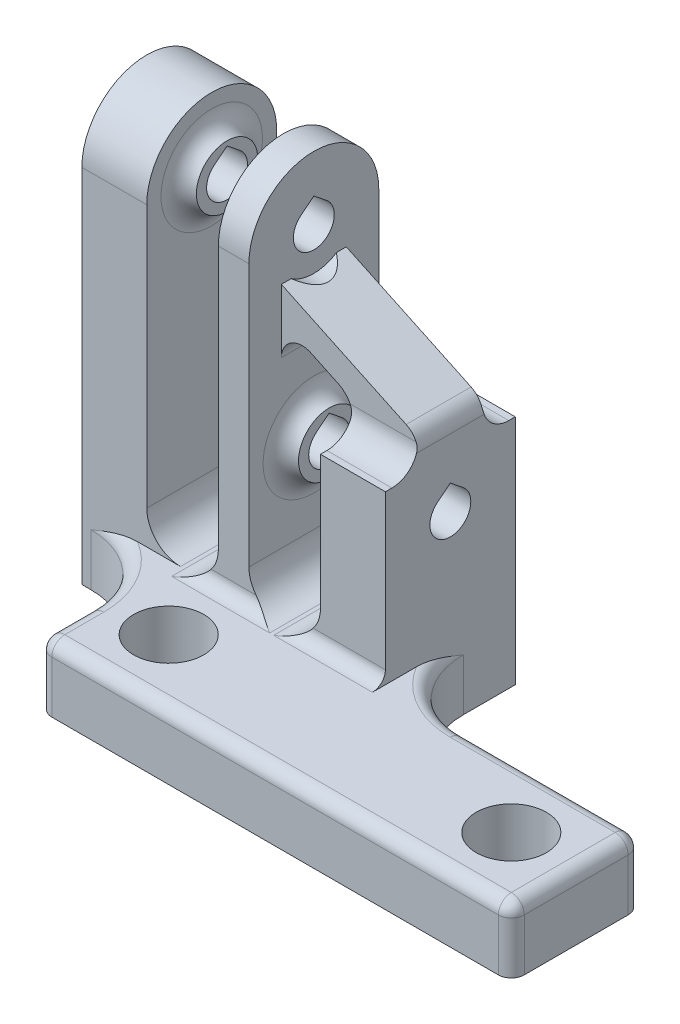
SolidWorks part; units mm, degrees
ref_plane "Front Plane" through (0, 0, 0) normal (0, 0, 1) x (1, 0, 0)
ref_plane "Top Plane" through (0, 0, 0) normal (0, 1, 0) x (1, 0, 0)
ref_plane "Right Plane" through (0, 0, 0) normal (1, 0, 0) x (0, 0, -1)
sketch "Sketch1" plane through (0, 0, 0) normal (0, 0, 1) x (1, 0, 0)
  line L1 (1.4925, 20.8434) -> (-1.4925, 20.8434)
  line L2 (1.4925, 20.8434) -> (1.4925, -20.8434)
  line L3 (1.4925, -20.8434) -> (-1.4925, -20.8434)
  line L4 (-1.4925, 20.8434) -> (-1.4925, -20.8434)
  line L5 (1.4925, 20.8434) -> (-1.4925, -20.8434) construction
  line L6 (1.4925, -20.8434) -> (-1.4925, 20.8434) construction
  point P0 (0, 0)
  dimension "D3" = 2.985
  dimension "D4" = 41.6868
extrude "Boss-Extrude1" add sketch "Sketch1" along normal blind 12.7
sketch "Sketch5" plane through (1.4925, 0, 0) normal (1, 0, 0) x (0, 0, -1)
  line L0 (-12.7, 20.8434) -> (0, 20.8434) construction
  circle A0 centre (-6.35, 14.4934) radius 2
  point P5 (-6.35, 20.8434)
  dimension "D2" = 4
  dimension "D1" = 6.35
extrude "Cut-Extrude2" cut sketch "Sketch5" against normal through all
sketch "Sketch8" plane through (0, 0, 12.7) normal (0, 0, 1) x (1, 0, 0)
  line L0 (1.4925, -20.8434) -> (-1.4925, -20.8434) construction
  line L1 (-6.35, -20.8434) -> (6.35, -20.8434)
  line L2 (-6.35, -20.8434) -> (-6.35, -14.4934)
  line L3 (-6.35, -14.4934) -> (6.35, -14.4934)
  line L4 (6.35, -20.8434) -> (6.35, -14.4934)
  point P5 (0, -14.4934)
  dimension "D1" = 6.35
  dimension "D2" = 12.7
extrude "Boss-Extrude2" add sketch "Sketch8" along normal blind 12.7
sketch "Sketch9" plane through (0, -14.4934, 0) normal (0, 1, 0) x (1, 0, 0)
  line L0 (-6.35, -19.05) -> (6.35, -19.05) construction
  line L1 (-6.35, -25.4) -> (-6.35, -12.7) construction
  line L2 (6.35, -25.4) -> (6.35, -12.7) construction
  circle A0 centre (0, -19.05) radius 3.429
  point P9 (0, -19.05)
  dimension "D1" = 6.858
extrude "Cut-Extrude3" cut sketch "Sketch9" against normal blind 12.7
sketch "Sketch10" plane through (0, 20.8434, 0) normal (0, 1, 0) x (1, 0, 0)
  line L0 (0, -12.7) -> (0, 0) construction
  line L1 (1.4925, -12.7) -> (-1.4925, -12.7) construction
ref_plane "Plane1" through (0, 0, 6.35) normal (0, 0, -1) x (-1, 0, 0)
mirror "Mirror1" about plane through (0, 0, 6.35) normal (0, 0, -1) of "Boss-Extrude2", "Cut-Extrude3"
sketch "Sketch11" plane through (0, 0, 12.7) normal (0, 0, -1) x (-1, 0, 0)
  line L1 (-6.35, -14.4934) -> (6.35, -14.4934)
  line L2 (-6.35, -14.4934) -> (-6.35, -20.8434)
  line L3 (-6.35, -20.8434) -> (6.35, -20.8434)
  line L4 (6.35, -14.4934) -> (6.35, -20.8434)
extrude "Boss-Extrude3" add sketch "Sketch11" along normal up to surface (12.7 mm away)
sketch "Sketch12" plane through (1.4925, 0, 0) normal (1, 0, 0) x (0, 0, -1)
  line L0 (-6.35, -25.0655) -> (-6.35, 25.0655) construction
  circle A0 centre (-6.35, -3.1444) radius 2
  circle A1 centre (-6.35, 14.4934) radius 2 construction
  dimension "D1" = 4
  dimension "D2" = 17.6378
extrude "Cut-Extrude4" cut sketch "Sketch12" against normal up to next
sketch "Sketch15" plane through (-1.4925, 0, 0) normal (-1, 0, 0) x (0, 0, 1)
  circle A0 centre (6.35, 14.4934) radius 3
  circle A1 centre (6.35, 14.4934) radius 2
  circle A2 centre (6.35, 14.4934) radius 2 construction
  dimension "D1" = 1
extrude "Boss-Extrude5" add sketch "Sketch15" along normal blind 1.5
sketch "Sketch16" plane through (1.4925, 0, 0) normal (1, 0, 0) x (0, 0, -1)
  circle A0 centre (-6.35, -3.1444) radius 3
  circle A1 centre (-6.35, -3.1444) radius 2
  circle A2 centre (-6.35, -3.1444) radius 2 construction
  dimension "D1" = 1
extrude "Boss-Extrude6" add sketch "Sketch16" along normal blind 1.5
sketch "Sketch13" plane through (0, 0, 6.35) normal (0, 0, -1) x (-1, 0, 0)
  line L5 (-1.4925, 20.8434) -> (1.4925, 20.8434) construction
  line L7 (-14.8425, -20.8434) -> (-14.8425, 20.8434)
  line L8 (-14.8425, 20.8434) -> (-8.4925, 20.8434)
  line L9 (-8.4925, -20.8434) -> (-8.4925, 20.8434)
  line L11 (-14.8425, -20.8434) -> (-8.4925, -20.8434)
  line L12 (6.35, -20.8434) -> (-6.35, -20.8434) construction
  line L14 (8.4925, 20.8434) -> (14.8425, 20.8434)
  line L15 (8.4925, 20.8434) -> (8.4925, -20.8434)
  line L16 (8.4925, -20.8434) -> (14.8425, -20.8434)
  line L17 (14.8425, 20.8434) -> (14.8425, -20.8434)
  line L18 (-2.9925, -0.1444) -> (-2.9925, -6.1444) construction
  line L19 (2.9925, 11.4934) -> (2.9925, 17.4934) construction
  line L20 (-8.4925, -20.8434) -> (-1.4925, -20.8434)
  line L21 (-8.4925, -20.8434) -> (-8.4925, -14.4934)
  line L22 (-8.4925, -14.4934) -> (-1.4925, -14.4934)
  line L23 (-1.4925, -20.8434) -> (-1.4925, -14.4934)
  line L25 (8.4925, -20.8434) -> (1.4925, -20.8434)
  line L26 (8.4925, -20.8434) -> (8.4925, -14.4934)
  line L27 (8.4925, -14.4934) -> (1.4925, -14.4934)
  line L28 (1.4925, -20.8434) -> (1.4925, -14.4934)
  dimension "D1" = 5.5
  dimension "D2" = 6.35
  dimension "D3" = 5.5
extrude "Boss-Extrude4" add sketch "Sketch13" along normal mid plane 12.7 contours L7 L11 L9 L8 | L20 L23 L22 L9 | L17 L14 L15 L16 | L28 L25 L15 L27
sketch "Sketch17" plane through (-14.8425, 0, 0) normal (-1, 0, 0) x (0, 0, 1)
  line L0 (0, 18.8775) -> (12.7, 18.8775) construction
  line L1 (0, 20.8434) -> (0, -20.8434) construction
  line L2 (12.7, 20.8434) -> (12.7, -20.8434) construction
  circle A0 centre (6.35, 14.4934) radius 2
  circle A1 centre (6.35, -3.1444) radius 2
  circle A2 centre (6.35, 14.4934) radius 2 construction
  circle A3 centre (6.35, -3.1444) radius 2 construction
  point P11 (6.35, 18.8775)
extrude "Cut-Extrude5" cut sketch "Sketch17" against normal up to surface (29.685 mm away)
sketch "Sketch18" plane through (8.4925, 0, 0) normal (-1, 0, 0) x (0, 0, 1)
  circle A0 centre (6.35, -3.1444) radius 3
  circle A1 centre (6.35, -3.1444) radius 2
  circle A2 centre (6.35, -3.1444) radius 2 construction
  dimension "D1" = 1
extrude "Boss-Extrude7" add sketch "Sketch18" along normal blind 1.5
sketch "Sketch19" plane through (-8.4925, 0, 0) normal (1, 0, 0) x (0, 0, -1)
  circle A0 centre (-6.35, 14.4934) radius 3
  circle A1 centre (-6.35, 14.4934) radius 2
  circle A2 centre (-6.35, 14.4934) radius 2 construction
  dimension "D1" = 1
extrude "Boss-Extrude8" add sketch "Sketch19" along normal blind 1.5
sketch "Sketch20" plane through (0, 0, 0) normal (0, 0, -1) x (-1, 0, 0)
  line L0 (-8.4925, -14.4934) -> (-8.4925, 20.8434) construction
  line L1 (-14.8425, 20.8434) -> (-8.4925, 20.8434)
  line L2 (-14.8425, 20.8434) -> (-14.8425, 1.8556)
  line L3 (-14.8425, 1.8556) -> (-8.4925, 1.8556)
  line L4 (-8.4925, 20.8434) -> (-8.4925, 1.8556)
  line L5 (-6.9925, -0.1444) -> (-8.4925, -0.1444) construction
  dimension "D1" = 2
extrude "Cut-Extrude6" cut sketch "Sketch20" against normal up to next
sketch "Sketch21" plane through (-14.8425, 0, 0) normal (-1, 0, 0) x (0, 0, 1)
  circle A0 centre (6.35, -3.1444) radius 2
  circle A1 centre (6.35, -3.1444) radius 2 construction
extrude "Boss-Extrude9" add sketch "Sketch21" against normal up to surface (6.35 mm away)
sketch "Sketch22" plane through (0, 0, 6.35) normal (0, 0, 1) x (1, 0, 0)
  line L0 (8.4925, -14.4934) -> (8.4925, 1.8556) construction
  line L1 (14.8425, 1.8556) -> (8.4925, 1.8556)
  line L2 (14.8425, 1.8556) -> (14.8425, 4.8556)
  line L3 (14.8425, 4.8556) -> (8.4925, 4.8556)
  line L4 (8.4925, 1.8556) -> (8.4925, 4.8556)
  line L10 (8.4925, 4.8556) -> (1.4925, 8.1627)
  line L11 (1.4925, 20.8434) -> (1.4925, -14.4934) construction
  line L12 (1.4925, 8.1627) -> (1.4925, 11.1627)
  line L13 (1.4925, 11.1627) -> (14.8425, 4.8556)
  dimension "D1" = 3
  dimension "D2" = 3
extrude "Boss-Extrude10" add sketch "Sketch22" against normal mid plane 6.35
sketch "Sketch23" plane through (0, 0, 6.35) normal (0, 0, -1) x (-1, 0, 0)
  line L0 (1.4925, -7.4934) -> (8.4925, -14.4934)
  line L1 (1.4925, 20.8434) -> (1.4925, -14.4934) construction
  line L2 (8.4925, -14.4934) -> (1.4925, -14.4934)
  line L3 (-6.35, -14.4934) -> (6.35, -14.4934) construction
  line L4 (1.4925, -14.4934) -> (1.4925, -7.4934)
sketch "Sketch24" plane through (1.4925, 0, 0) normal (1, 0, 0) x (0, 0, -1)
  circle A0 centre (-6.35, 14.4934) radius 4
  dimension "D1" = 8
extrude "Cut-Extrude8" cut sketch "Sketch24" along normal blind 6.35
fillet "Fillet3" radius 2 1 edges at (14.8425, 4.8556, 6.35)
fillet "Fillet6" radius 3.302 2 edges at (-1.4925, -14.4934, 6.35) (-8.4925, -14.4934, 6.35)
fillet "Fillet7" radius 2.54 1 edges at (8.4925, 4.8556, 6.35)
fillet "Fillet8" radius 2.54 2 edges at (11.6675, 1.8556, 3.175) (11.6675, 1.8556, 9.525)
fillet "Fillet9" radius 3.302 2 edges at (8.4925, -14.4934, 6.35) (1.4925, -14.4934, 6.35)
sketch "Sketch25" plane through (0, 0, -12.7) normal (0, 0, -1) x (-1, 0, 0)
  line L0 (-6.35, -14.2831) -> (-6.35, -20.8434) construction
  line L1 (-6.35, -14.4934) -> (6.35, -14.4934)
  line L2 (-6.35, -14.4934) -> (-6.35, -13.4232)
  line L3 (-6.35, -13.4232) -> (6.35, -13.4232)
  line L4 (6.35, -14.4934) -> (6.35, -13.4232)
  line L5 (-4.7945, -14.4934) -> (4.7945, -14.4934) construction
  line L6 (6.35, -14.2831) -> (6.35, -20.8434) construction
extrude "Cut-Extrude9" cut sketch "Sketch25" against normal up to surface (12.7 mm away)
sketch "Sketch26" plane through (0, 0, 25.4) normal (0, 0, 1) x (1, 0, 0)
  line L0 (-6.35, -14.2831) -> (-6.35, -20.8434) construction
  line L1 (-6.35, -14.4934) -> (6.35, -14.4934)
  line L2 (-6.35, -14.4934) -> (-6.35, -13.6774)
  line L3 (-6.35, -13.6774) -> (6.35, -13.6774)
  line L4 (6.35, -14.4934) -> (6.35, -13.6774)
  line L5 (6.35, -14.2831) -> (6.35, -20.8434) construction
  line L6 (5.1905, -14.4934) -> (-5.1905, -14.4934) construction
extrude "Cut-Extrude10" cut sketch "Sketch26" against normal up to surface (12.7 mm away)
fillet "Fillet10" radius 2.032 1 edges at (1.4925, 8.1627, 6.35)
sketch "Sketch27" plane through (-14.8425, 0, 0) normal (-1, 0, 0) x (0, 0, 1)
  line L0 (0, 20.8434) -> (12.7, 20.8434) construction
  line L1 (0, 14.4934) -> (0, 20.8434)
  line L2 (0, 20.8434) -> (12.7, 20.8434)
  line L3 (12.7, 20.8434) -> (12.7, 14.4934)
  circle A0 centre (6.35, 14.4934) radius 6.35
extrude "Cut-Extrude11" cut sketch "Sketch27" against normal through all contours A0 L2 M5 | A0 M3 M4
fillet "Fillet11" radius 2.032 4 edges at (1.4925, -0.1444, 6.35) (-8.4925, 11.4934, 6.35) (-1.4925, 17.4934, 6.35) (8.4925, -3.1444, 3.35)
sketch "Sketch28" plane through (1.4925, 0, 0) normal (1, 0, 0) x (0, 0, -1)
  line L0 (-6.35, 17.0549) -> (-7.5996, 16.0549)
  line L1 (-6.35, -25.0655) -> (-6.35, 25.0655) construction
  line L2 (-7.5996, 16.0549) -> (-5.1004, 16.0549)
  line L3 (-5.1004, 16.0549) -> (-6.35, 17.0549)
  circle A0 centre (-6.35, 14.4934) radius 2 construction
  point P4 (-6.35, 16.0549)
  dimension "D1" = 1
extrude "Cut-Extrude12" cut sketch "Sketch28" against normal through all
sketch "Sketch29" plane through (14.8425, 0, 0) normal (1, 0, 0) x (0, 0, -1)
  line L0 (-6.35, -0.5828) -> (-7.5996, -1.5828)
  line L1 (-6.35, -25.0655) -> (-6.35, 25.0655) construction
  line L2 (-7.5996, -1.5828) -> (-5.1004, -1.5828)
  line L3 (-5.1004, -1.5828) -> (-6.35, -0.5828)
  circle A0 centre (-6.35, -3.1444) radius 2 construction
  point P4 (-6.35, -1.5828)
  dimension "D1" = 1
extrude "Cut-Extrude13" cut sketch "Sketch29" against normal up to surface (16.335 mm away)
sketch "Sketch30" plane through (0, -14.4934, 0) normal (0, 1, 0) x (1, 0, 0)
  line L0 (8.4925, -12.7) -> (14.8425, -12.7) construction
  line L1 (6.35, -25.4) -> (39.8556, -25.4)
  line L2 (6.35, -25.4) -> (6.35, -12.7)
  line L3 (6.35, -12.7) -> (39.8556, -12.7)
  line L4 (39.8556, -25.4) -> (39.8556, -12.7)
  circle A0 centre (33.5056, -19.05) radius 3.429
  circle A1 centre (0, -19.05) radius 3.429 construction
  point P9 (0, 0)
  point P10 (39.8556, -19.05)
  dimension "D1" = 33.5056
  dimension "D2" = 6.35
extrude "Boss-Extrude11" add sketch "Sketch30" against normal up to surface (6.35 mm away)
sketch "Sketch31" plane through (0, -14.4934, 0) normal (0, 1, 0) x (1, 0, 0)
  line L0 (14.8425, 0) -> (8.4925, 0) construction
  line L1 (-10.0514, 13.3559) -> (13.5137, 13.3559)
  line L2 (-10.0514, 13.3559) -> (-10.0514, 0)
  line L3 (-10.0514, 0) -> (13.5137, 0)
  line L4 (13.5137, 13.3559) -> (13.5137, 0)
extrude "Cut-Extrude14" cut sketch "Sketch31" against normal up to surface (6.35 mm away)
fillet "Fillet12" radius 7.62 2 edges at (14.8425, -17.6684, 12.7) (-6.35, -17.6684, 12.7)
fillet "Fillet13" radius 1.27 8 edges at (16.7528, -14.4934, 25.4) (-6.35, -17.6684, 25.4) (39.8556, -17.6684, 12.7) (39.8556, -17.6684, 25.4) (39.8556, -14.4934, 19.05) (-6.35, -14.4934, 22.86) (17.0743, -14.4934, 10.4682) (-8.5818, -14.4934, 14.9318)
